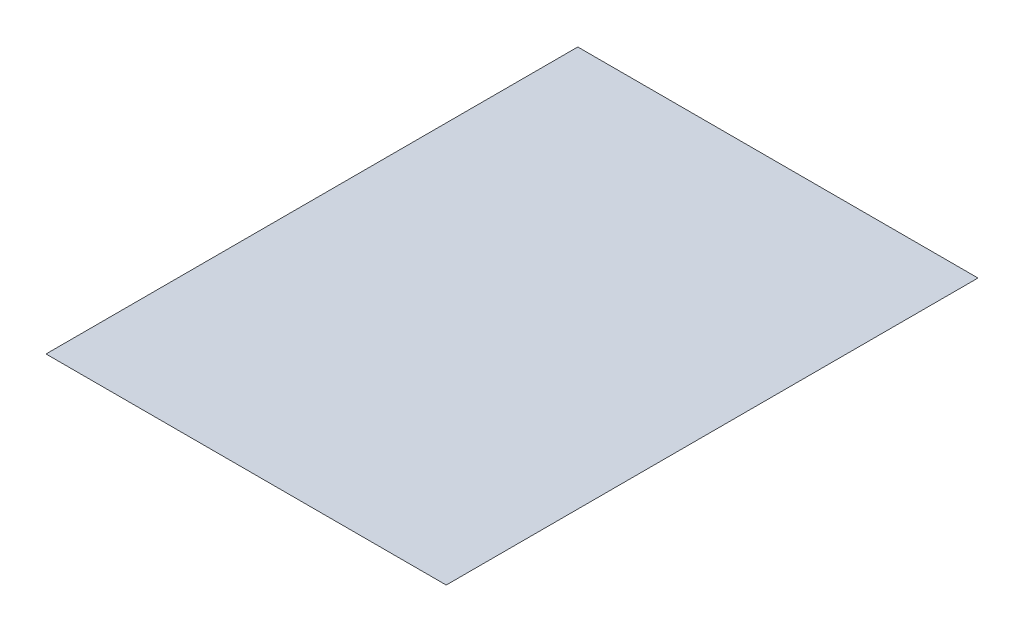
SolidWorks part; units mm, degrees
ref_plane "Plane1" through (0, 0, 0) normal (0, 0, 1) x (1, 0, 0)
ref_plane "Plane2" through (0, 0, 0) normal (0, 1, 0) x (1, 0, 0)
ref_plane "Plane3" through (0, 0, 0) normal (1, 0, 0) x (0, 0, -1)
sketch "Sketch1" plane through (0, 0, 0) normal (0, 0, 1) x (1, 0, 0)
  line L1 (-3559.8185, 56.5358) -> (3559.8185, 56.5358)
  line L2 (-3559.8185, 56.5358) -> (-3559.8185, 0)
  line L3 (-3559.8185, 0) -> (3559.8185, 0)
  line L4 (3559.8185, 56.5358) -> (3559.8185, 0)
extrude "Extrude1" add sketch "Sketch1" along normal mid plane 5000
sketch "Sketch2" plane through (0, 0, 0) normal (0, -1, 0) x (1, 0, 0)
  line L0 (-60, 0) -> (60, 0) construction
  line L1 (60, 80) -> (-60, 80)
  line L2 (60, 80) -> (60, -80)
  line L3 (60, -80) -> (-60, -80)
  line L4 (-60, 80) -> (-60, -80)
  dimension "length" = 160
  dimension "width" = 120
extrude "Extrude2" add sketch "Sketch2" along normal blind 20
sketch "Sketch3" plane through (60, 0, 0) normal (1, 0, 0) x (0, 0, -1)
  line L0 (-2500, 0) -> (2500, 0) construction
  line L1 (-2500, 0) -> (-80, 0)
  line L2 (-80, 0) -> (0, -20)
  line L3 (80, -20) -> (-80, -20) construction
  line L4 (0, -20) -> (80, 0)
  line L5 (80, 0) -> (2500, 0)
extrude "Cut-Extrude1" cut sketch "Sketch3" against normal through all and the other way through all flip side to cut
sketch "Sketch4" plane through (0, 0, 0) normal (0, 0, 1) x (1, 0, 0)
  line L0 (-60, 0) -> (0, -20)
  line L1 (-3559.8185, 0) -> (3559.8185, 0) construction
  line L2 (60, -20) -> (-60, -20) construction
  line L3 (0, -20) -> (60, 0)
  line L4 (-3559.8185, 0) -> (-60, 0)
  line L5 (60, 0) -> (3559.8185, 0)
extrude "Cut-Extrude2" cut sketch "Sketch4" against normal through all and the other way through all flip side to cut
fillet "Fillet1" radius 3 4 edges at (60, 0, 0) (0, 0, 80) (-60, 0, 0) (0, 0, -80)
fillet "Fillet2" radius 3 12 edges at (-29.7691, -10.077, -39.6921) (29.7691, -10.077, 39.6921) (29.7691, -10.077, -39.6921) (-29.7691, -10.077, 39.6921) (59.6481, -0.1196, 79.5214) (59.6481, -0.1196, -79.5214) (-59.6481, -0.1196, -79.5214) (-59.6481, -0.1196, 79.5214) (-60.1203, -0.0225, 80.0028) (60.1203, -0.0225, 80.0028) (-60.1203, -0.0225, -80.0028) (60.1203, -0.0225, -80.0028)
sketch "Sketch5" plane through (0, 0, 2500) normal (0, 0, 1) x (1, 0, 0)
  line L4 (-3559.8185, 56.5358) -> (-3559.8185, 0)
  line L5 (-3559.8185, 0) -> (3559.8185, 0)
  line L6 (3559.8185, 0) -> (3559.8185, 56.5358)
  line L7 (3559.8185, 56.5358) -> (-3559.8185, 56.5358)
  line L8 (-3559.8185, 56.5358) -> (-3559.8185, 0)
  line L9 (-3559.8185, 0) -> (3559.8185, 0)
  line L10 (3559.8185, 0) -> (3559.8185, 56.5358)
  line L11 (3559.8185, 56.5358) -> (-3559.8185, 56.5358)
  dimension "D1" = 0
extrude "Cut-Extrude3" cut sketch "Sketch5" against normal through all
sketch "Sketch6" plane through (0, 0, 0) normal (0, 1, 0) x (-1, 0, 0)
  line L4 (-60.4868, 80.3693) -> (-60.4868, -80.3693)
  line L5 (-60.4868, -80.3693) -> (60.4868, -80.3693)
  line L6 (60.4868, -80.3693) -> (60.4868, 80.3693)
  line L7 (60.4868, 80.3693) -> (-60.4868, 80.3693)
  line L8 (-60.4868, 80.3693) -> (-60.4868, -80.3693)
  line L9 (-60.4868, -80.3693) -> (60.4868, -80.3693)
  line L10 (60.4868, -80.3693) -> (60.4868, 80.3693)
  line L11 (60.4868, 80.3693) -> (-60.4868, 80.3693)
  dimension "D1" = 0
